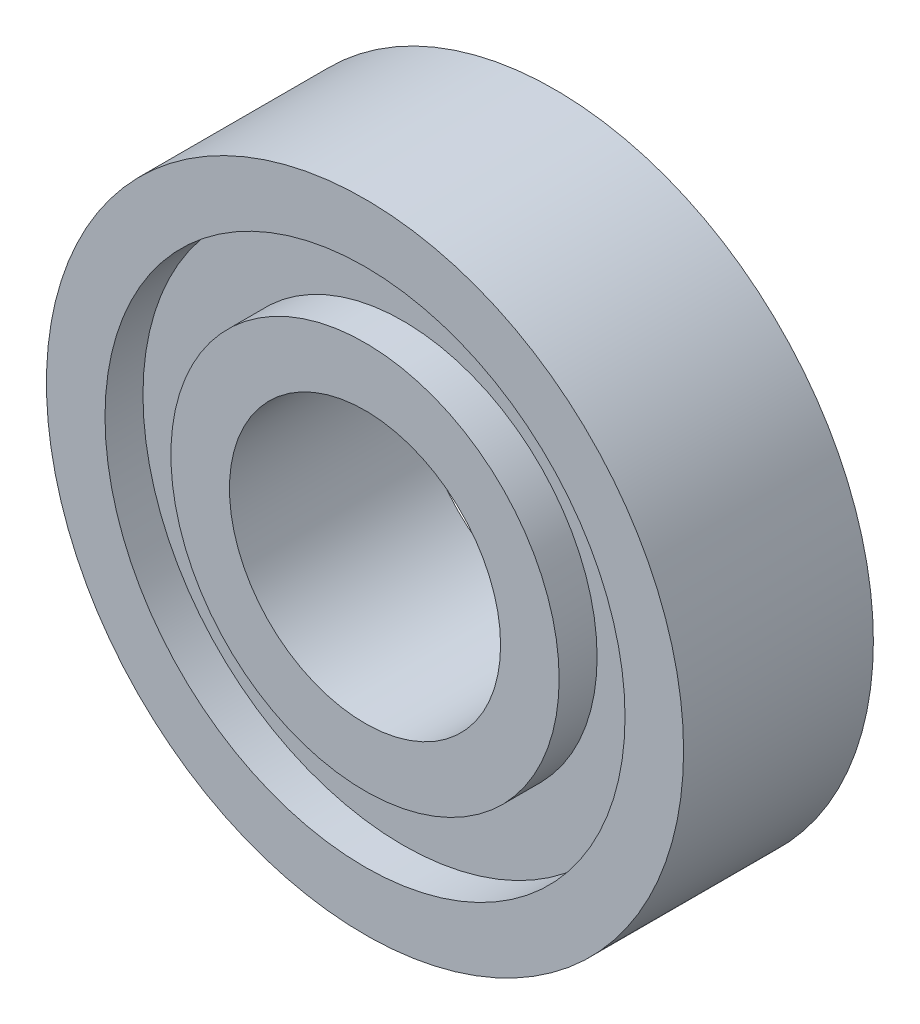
SolidWorks part; units mm, degrees
ref_plane "Front Plane" through (0, 0, 0) normal (0, 0, 1) x (1, 0, 0)
ref_plane "Top Plane" through (0, 0, 0) normal (0, 1, 0) x (1, 0, 0)
ref_plane "Right Plane" through (0, 0, 0) normal (1, 0, 0) x (0, 0, -1)
sketch "Skizze1" plane through (0, 0, 0) normal (0, 0, 1) x (1, 0, 0)
  circle A0 centre (0, 0) radius 23.5
  circle A1 centre (0, 0) radius 19.18
  dimension "D1" = 47
extrude "Aufsatz-Linear austragen1" add sketch "Skizze1" along normal mid plane 14
sketch "Skizze2" plane through (0, 0, 0) normal (0, 0, 1) x (1, 0, 0)
  circle A0 centre (0, 0) radius 14.32
  circle A1 centre (0, 0) radius 10
  dimension "D1" = 20
extrude "Aufsatz-Linear austragen2" add sketch "Skizze2" along normal mid plane 14
sketch "Skizze3" plane through (0, 0, 0) normal (0, 0, 1) x (1, 0, 0)
  circle A0 centre (0, 0) radius 19.18
  circle A1 centre (0, 0) radius 14.32
extrude "Aufsatz-Linear austragen3" add sketch "Skizze3" along normal mid plane 8.4
